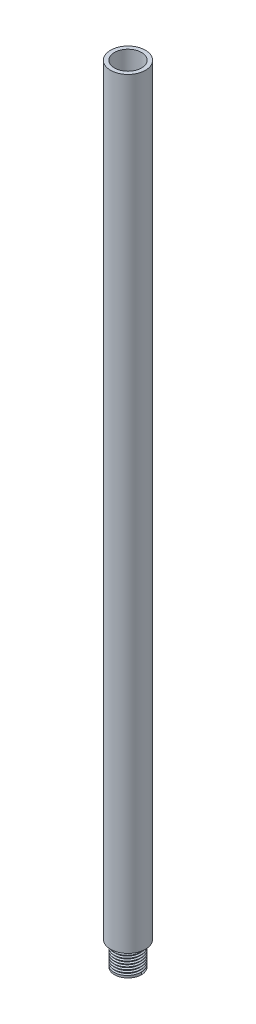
SolidWorks part; units mm, degrees
ref_plane "Front Plane" through (0, 0, 0) normal (0, 0, 1) x (1, 0, 0)
ref_plane "Top Plane" through (0, 0, 0) normal (0, 1, 0) x (1, 0, 0)
ref_plane "Right Plane" through (0, 0, 0) normal (1, 0, 0) x (0, 0, -1)
sketch "Sketch2" plane through (0, 0, 0) normal (0, 1, 0) x (1, 0, 0)
  circle A0 centre (0, 0) radius 7.366
  point P3 (0, 0)
  dimension "D1" = 14.732
extrude "Boss-Extrude1" add sketch "Sketch2" along normal mid plane 321.7333
sketch "Sketch3" plane through (0, -160.8667, 0) normal (0, 1, 0) x (1, 0, 0)
  circle A0 centre (0, 0) radius 5.715
  dimension "D1" = 11.43
extrude "Boss-Extrude2" add sketch "Sketch3" against normal blind 10.16
thread "Thread1" pitch 1.0583 start angle 0, offset 0, length 10.16, pitch 1.0583, diameter 11.43
ref_plane "Plane1" through (5.715, -171.0267, 0) normal (0, 0, 1) x (1, 0, 0)
sketch "Thread Profile1" plane through (5.715, -171.0267, 0) normal (0, 0, 1) x (1, 0, 0)
  line L0 (0, 0) -> (0, 1.0583) construction
  line L11 (0, 0) -> (0, 0.926)
  line L12 (0, 0.926) -> (-0.5728, 0.5953)
  line L13 (-0.5728, 0.5953) -> (-0.5728, 0.3307)
  line L15 (-0.5728, 0.3307) -> (0, 0)
  line L17 (-0.5728, 0.463) -> (0, 0.463) construction
  point P2 (0, 0)
  dimension "Pitch" = 1.0583
  dimension "Profile_Angle" = 60
  dimension "Profile_Land" = 0.2646
  dimension "Profile_Height" = 0.5728
sketch "Sketch8" plane through (0, 160.8667, 0) normal (0, -1, 0) x (-1, 0, 0)
  circle A0 centre (0, 0) radius 5.715
  point P3 (0, 0)
  point P5 (0, 0)
  point P6 (0, 0)
  dimension "D1" = 11.43
extrude "Cut-Extrude1" cut sketch "Sketch8" along normal blind 10.16
